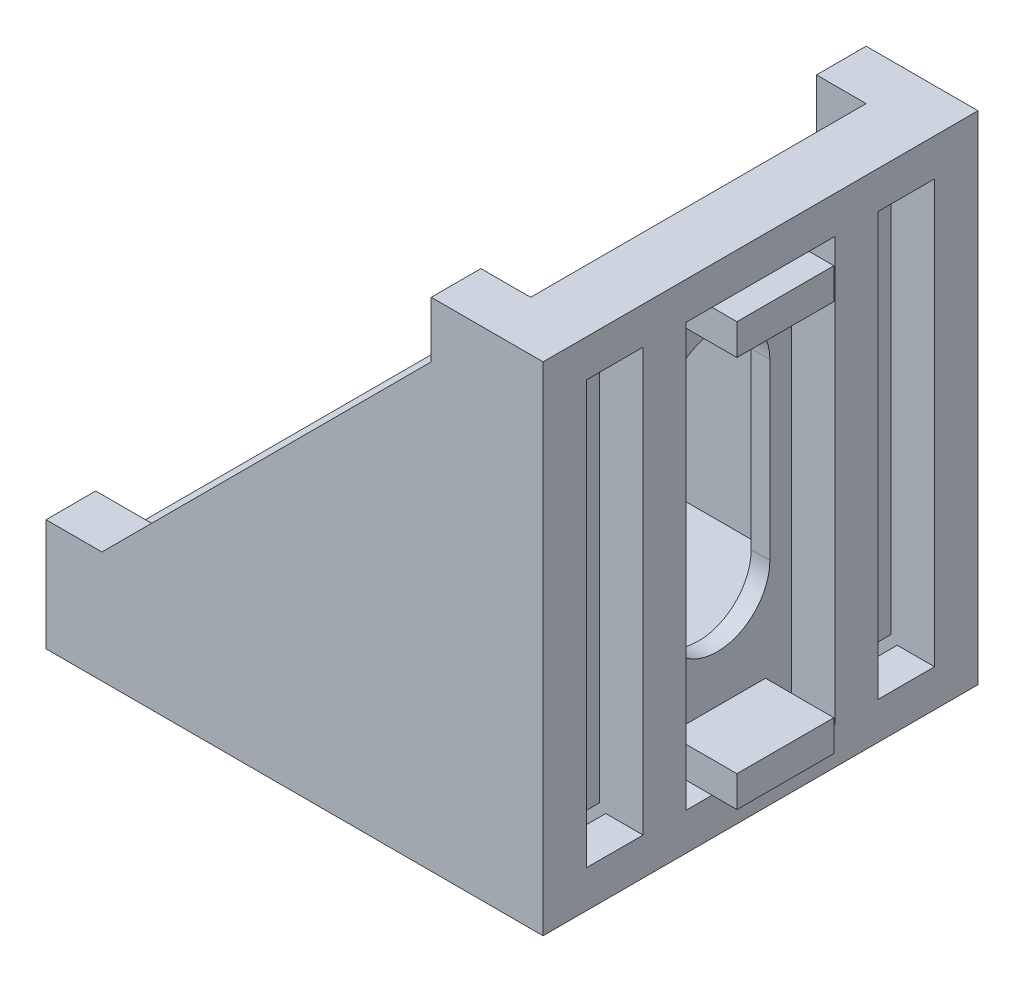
SolidWorks part; units mm, degrees
ref_plane "前视基准面" through (0, 0, 0) normal (0, 0, 1) x (1, 0, 0)
ref_plane "上视基准面" through (0, 0, 0) normal (0, 1, 0) x (1, 0, 0)
ref_plane "右视基准面" through (0, 0, 0) normal (1, 0, 0) x (0, 0, -1)
sketch "草图1" plane through (0, 0, 0) normal (0, 0, 1) x (1, 0, 0)
  line L1 (-20, 20) -> (20, 20)
  line L2 (-20, 20) -> (-20, -20)
  line L3 (-20, -20) -> (20, -20)
  line L4 (20, 20) -> (20, -20)
  dimension "D1" = 40
  dimension "D2" = 40
  dimension "D3" = 20
extrude "凸台-拉伸1" add sketch "草图1" along normal mid plane 35
sketch "草图2" plane through (0, 0, 17.5) normal (0, 0, 1) x (1, 0, 0)
  line L0 (11, 20) -> (11, 15.5)
  line L1 (20, 20) -> (-20, 20) construction
  line L2 (11, 15.5) -> (-15.5, -11)
  line L3 (-15.5, -11) -> (-20, -11)
  line L4 (-20, 20) -> (-20, -20) construction
  line L5 (-20, -11) -> (-20, 20)
  line L6 (-20, 20) -> (11, 20)
  line L7 (20, -20) -> (20, 20) construction
  line L8 (-20, -20) -> (20, -20) construction
  dimension "D1" = 9
  dimension "D2" = 9
  dimension "D3" = 4.5
  dimension "D4" = 4.5
extrude "切除-拉伸1" cut sketch "草图2" against normal through all
sketch "草图3" plane through (0, 20, 0) normal (0, 1, 0) x (1, 0, 0)
  line L0 (15, 13.5) -> (15, -13.5)
  line L1 (15, -13.5) -> (-20, -13.5)
  line L2 (-20, 17.5) -> (-20, -17.5) construction
  line L3 (-20, -13.5) -> (-20, 13.5)
  line L4 (-20, 13.5) -> (15, 13.5)
  line L5 (-15.5, -17.5) -> (11, -17.5) construction
  line L6 (-15.5, 17.5) -> (11, 17.5) construction
  dimension "D1" = 35
  dimension "D2" = 4
  dimension "D3" = 4
extrude "切除-拉伸2" cut sketch "草图3" against normal blind 35
sketch "草图4" plane through (20, 0, 0) normal (1, 0, 0) x (0, 0, -1)
  line L0 (-17.5, 20) -> (17.5, 20) construction
  line L1 (-14, 17) -> (-9.4524, 17)
  line L2 (-14, 17) -> (-14, -17)
  line L3 (-14, -17) -> (-9.4524, -17)
  line L4 (-9.4524, 17) -> (-9.4524, -17)
  line L5 (-17.5, -20) -> (17.5, -20) construction
  line L6 (-17.5, -20) -> (-17.5, 20) construction
  line L7 (0, 19.5848) -> (0, -20) construction
  line L8 (9.4524, 17) -> (9.4524, -17)
  line L9 (14, -17) -> (9.4524, -17)
  line L10 (14, 17) -> (14, -17)
  line L11 (14, 17) -> (9.4524, 17)
  line L13 (-6, 17) -> (6, 17)
  line L14 (-6, 17) -> (-6, -17)
  line L15 (-6, -17) -> (6, -17)
  line L16 (6, 17) -> (6, -17)
  dimension "D1" = 3
  dimension "D2" = 3
  dimension "D3" = 3.5
  dimension "D4" = 12
  dimension "D5" = 6
extrude "切除-拉伸3" cut sketch "草图4" against normal blind 3.5
sketch "草图5" plane through (16.5, 0, 0) normal (1, 0, 0) x (0, 0, -1)
  line L0 (0, 7.5397) -> (0, -6.4603) construction
  line L1 (4.25, 7.5397) -> (4.25, -6.4603)
  line L2 (-4.25, 7.5397) -> (-4.25, -6.4603)
  arc A0 (4.25, 7.5397) -> (-4.25, 7.5397) centre (0, 7.5397) ccw
  arc A1 (-4.25, -6.4603) -> (4.25, -6.4603) centre (0, -6.4603) ccw
  point P3 (0, 0.5397)
  dimension "D2" = 4.25
  dimension "D1" = 14
extrude "切除-拉伸4" cut sketch "草图5" against normal blind 3.5
sketch "草图6" plane through (16.5, 0, 0) normal (1, 0, 0) x (0, 0, -1)
  line L0 (6, 17) -> (-6, 17) construction
  line L1 (-3.9, 17) -> (3.9, 17)
  line L2 (-3.9, 17) -> (-3.9, 14.5)
  line L3 (-3.9, 14.5) -> (3.9, 14.5)
  line L4 (3.9, 17) -> (3.9, 14.5)
  line L5 (-6, -17) -> (6, -17) construction
  line L6 (-3.9, -17) -> (3.9, -17)
  line L7 (-3.9, -17) -> (-3.9, -14.5)
  line L8 (-3.9, -14.5) -> (3.9, -14.5)
  line L9 (3.9, -17) -> (3.9, -14.5)
  line L10 (0, 17) -> (0, -17) construction
  dimension "D1" = 7.8
  dimension "D2" = 7.8
  dimension "D3" = 2.5
  dimension "D4" = 2.5
extrude "凸台-拉伸2" add sketch "草图6" along normal blind 5.5
ref_plane "基准面1" through (0, 0, 0) normal (0.7071, 0.7071, 0) x (0.7071, -0.7071, 0)
mirror "镜向1" about plane through (0, 0, 0) normal (0.7071, 0.7071, 0) of "切除-拉伸4", "凸台-拉伸2", "切除-拉伸3"
